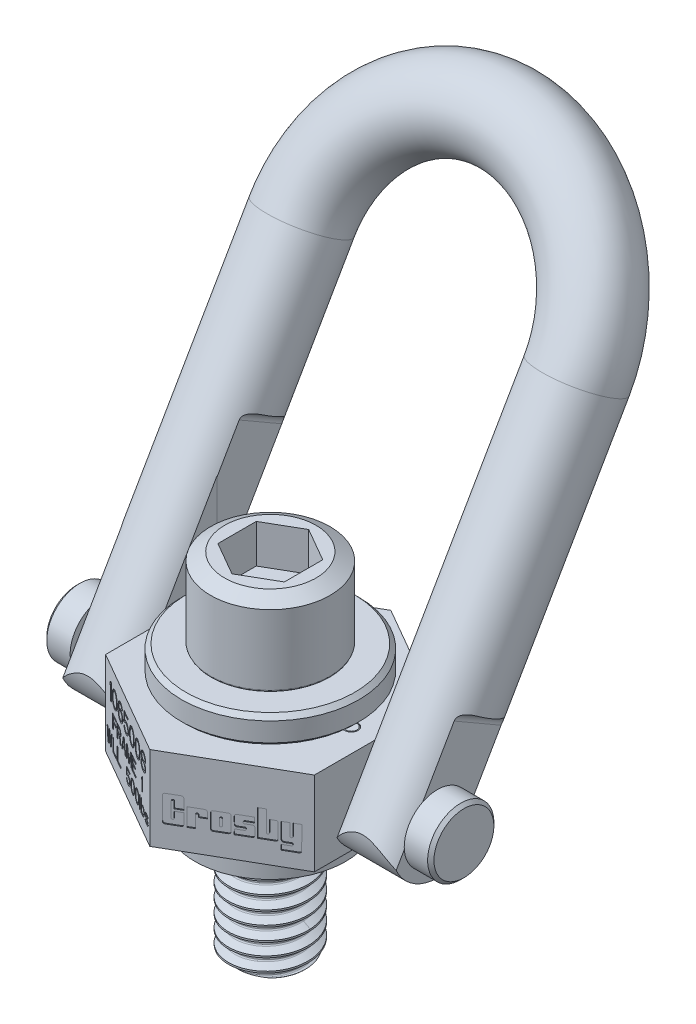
SolidWorks part; units mm, degrees
ref_plane "Front X-Y" through (0, 0, 0) normal (0, 0, 1) x (1, 0, 0)
ref_plane "Top X-Z" through (0, 0, 0) normal (0, 1, 0) x (1, 0, 0)
ref_plane "Right Y-Z" through (0, 0, 0) normal (1, 0, 0) x (0, 0, -1)
imported_body "Imported1"
sketch "Sketch2" plane through (0, 0, 0) normal (0, 0, 1) x (1, 0, 0)
  line L0 (12.4841, 14.3002) -> (12.4841, 4.2672) construction
  line L1 (-12.7, 27.5844) -> (12.4841, 27.5844)
  line L2 (-12.7, 27.5844) -> (-12.7, -25.8264)
  line L3 (-12.7, -25.8264) -> (12.4841, -25.8264)
  line L4 (12.4841, 27.5844) -> (12.4841, -25.8264)
  line L6 (5.4656, 27.5844) -> (-5.4656, 27.5844) construction
  line L7 (-12.7, 3.7116) -> (-12.7, 6.6549) construction
extrude "Cut-Extrude-Thin1" cut sketch "Sketch2" against normal blind 6.35 and the other way through all thin
pattern_circular "CirPattern1" count 5 every 30 about axis through (-23.9268, 8.9662, 0) along (1, 0, 0)
pattern_circular "CirPattern2" count 2 every 15 about axis through (23.9268, 8.9662, 0) along (-1, 0, 0)
sketch "Sketch1" plane through (0, 0, 0) normal (1, 0, 0) x (0, 0, -1)
  arc A0 (24.2918, 60.5658) -> (32.5407, 55.8033) centre (28.4163, 58.1846) ccw construction
  arc A1 (-46.8371, 41.5069) -> (-51.5996, 33.258) centre (-49.2184, 37.3825) ccw construction
  arc A2 (-24.2918, 60.5658) -> (-32.5407, 55.8033) centre (-28.4162, 58.1846) ccw construction
  arc A3 (-56.8325, 13.7287) -> (-56.8325, 4.2037) centre (-56.8325, 8.9662) ccw construction
  arc A4 (4.7625, 65.7987) -> (-4.7625, 65.7987) centre (0, 65.7987) ccw construction
  arc A5 (19.3096, 62.6296) -> (10.1091, 65.0948) centre (14.7093, 63.8622) ccw construction
  point P0 (26.035, 54.0601)
  point P1 (-49.2184, 37.3825)
  point P5 (-28.4162, 58.1846)
  point P12 (-56.8325, 8.9662)
  point P13 (0, 65.7987)
  point P20 (14.7093, 63.8622)
delete or keep bodies "Body-Delete2" [suppressed] type delete bodies bodies 110 111 112
delete or keep bodies "Body-Delete3" [suppressed] type delete bodies bodies 108
delete or keep bodies "Body-Delete4" [suppressed] type delete bodies bodies 108 109 110 111
delete or keep bodies "Body-Delete5" [suppressed] type delete bodies bodies 112 110 109 108
delete or keep bodies "Body-Delete6" [suppressed] type delete bodies bodies 112 111 109 108
delete or keep bodies "Body-Delete7" type delete bodies bodies 111 110 109 112
delete or keep bodies "Body-Delete8" [suppressed] type delete bodies bodies 108
delete or keep bodies "Body-Delete9" type delete bodies bodies 113
